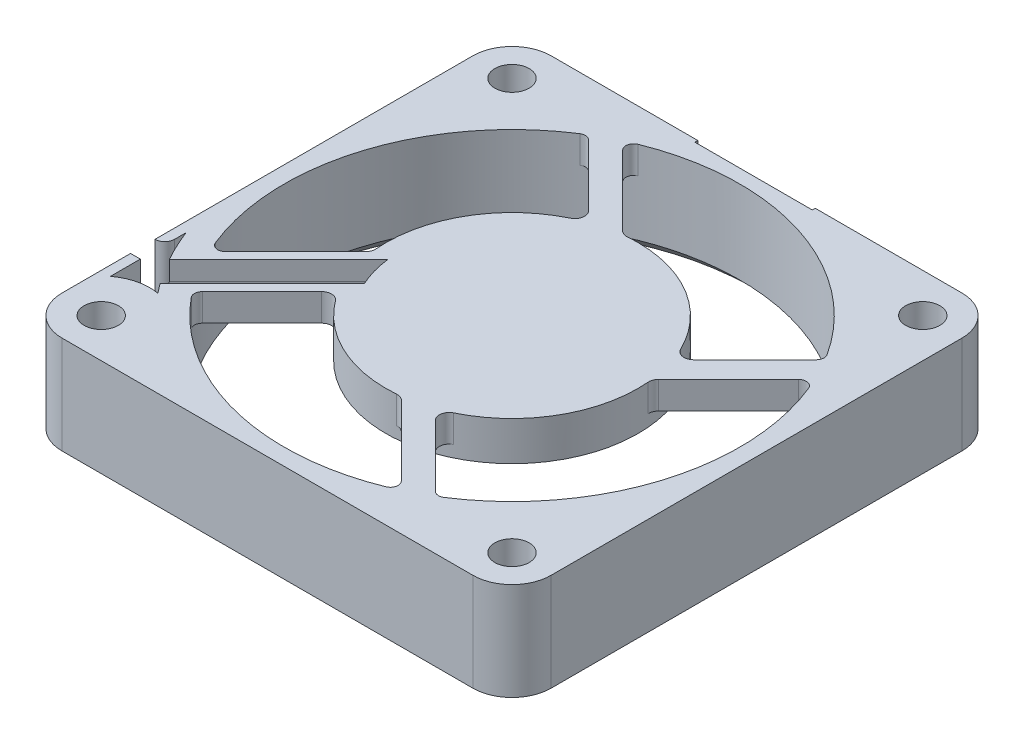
SolidWorks part; units mm, degrees
ref_plane "Спереди" through (0, 0, 0) normal (0, 0, 1) x (1, 0, 0)
ref_plane "Сверху" through (0, 0, 0) normal (0, 1, 0) x (1, 0, 0)
ref_plane "Справа" through (0, 0, 0) normal (1, 0, 0) x (0, 0, -1)
sketch "Эскиз1" plane through (0, 0, 0) normal (0, 1, 0) x (1, 0, 0)
  line L5 (371.8761, 130.3707) -> (371.8761, 129.2014)
  line L6 (370.8761, 160.7014) -> (370.8761, 128.2014)
  line L7 (389.8761, 164.7014) -> (374.8761, 164.7014)
  line L8 (389.8761, 164.7014) -> (389.8761, 164.4014)
  line L9 (401.8761, 164.4014) -> (389.8761, 164.4014)
  line L10 (401.8761, 164.4014) -> (401.8761, 164.7014)
  line L11 (416.8761, 164.7014) -> (401.8761, 164.7014)
  line L12 (420.8761, 118.7014) -> (420.8761, 160.7014)
  line L13 (374.8761, 114.7014) -> (416.8761, 114.7014)
  line L14 (370.8761, 125.7014) -> (370.8761, 118.7014)
  line L15 (370.8761, 125.7014) -> (371.8761, 125.7014)
  line L16 (371.8761, 122.6388) -> (371.8761, 125.7014)
  line L17 (384.0282, 132.0963) -> (377.9211, 125.9891)
  line L18 (415.3463, 151.3369) -> (409.0832, 145.0738)
  line L19 (375.5766, 130.7157) -> (382.7289, 137.868)
  line L20 (404.8618, 119.402) -> (397.7095, 126.5543)
  line L21 (390.5037, 152.9086) -> (384.2406, 159.1717)
  line L22 (386.8903, 160.0009) -> (394.0426, 152.8486)
  line L23 (401.2484, 126.4943) -> (407.5115, 120.2312)
  line L24 (409.0232, 141.5349) -> (416.1755, 148.6872)
  arc A0 (371.8761, 130.3707) -> (373.404, 127.1289) centre (395.8761, 139.7014) ccw
  arc A1 (370.8761, 128.2014) -> (371.8761, 129.2014) centre (370.8761, 129.2014) ccw
  arc A2 (374.8761, 164.7014) -> (370.8761, 160.7014) centre (374.8761, 160.7014) ccw
  arc A3 (420.8761, 160.7014) -> (416.8761, 164.7014) centre (416.8761, 160.7014) ccw
  arc A4 (416.8761, 114.7014) -> (420.8761, 118.7014) centre (416.8761, 118.7014) ccw
  arc A5 (370.8761, 118.7014) -> (374.8761, 114.7014) centre (374.8761, 118.7014) ccw
  arc A6 (375.8114, 123.5623) -> (371.8761, 122.6388) centre (374.8761, 118.7014) ccw
  arc A7 (375.0607, 124.5429) -> (375.8114, 123.5623) centre (395.8761, 139.7014) ccw
  circle A8 centre (416.8761, 160.7014) radius 1.75
  circle A9 centre (374.8761, 118.7014) radius 1.75
  circle A10 centre (416.8761, 118.7014) radius 1.75
  circle A11 centre (374.8761, 160.7014) radius 1.75
  arc A12 (377.8685, 124.9158) -> (404.5955, 118.0945) centre (395.8761, 139.7014) ccw
  arc A13 (377.9211, 125.9891) -> (377.8685, 124.9158) centre (378.4868, 125.4234) ccw
  arc A14 (385.5368, 131.9872) -> (396.9214, 126.8439) centre (395.8761, 139.7014) ccw
  arc A15 (385.5368, 131.9872) -> (384.0282, 132.0963) centre (384.7353, 131.3892) ccw
  arc A16 (415.3463, 151.3369) -> (415.4528, 152.3364) centre (414.7806, 151.9026) ccw
  arc A17 (382.7289, 137.868) -> (383.0185, 138.6561) centre (382.0218, 138.5751) ccw
  arc A18 (404.5955, 118.0945) -> (404.8618, 119.402) centre (404.2961, 118.8363) ccw
  arc A19 (397.7095, 126.5543) -> (396.9214, 126.8439) centre (397.0024, 125.8472) ccw
  arc A20 (390.234, 151.3022) -> (390.5037, 152.9086) centre (389.7966, 152.2014) ccw
  arc A21 (394.0426, 152.8486) -> (394.8307, 152.559) centre (394.7497, 153.5557) ccw
  arc A22 (407.5115, 120.2312) -> (408.5111, 120.1247) centre (408.0772, 120.7969) ccw
  arc A23 (383.2411, 159.2781) -> (374.2691, 130.982) centre (395.8761, 139.7014) ccw
  arc A24 (374.2691, 130.982) -> (375.5766, 130.7157) centre (375.011, 131.2814) ccw
  arc A25 (387.1567, 161.3084) -> (386.8903, 160.0009) centre (387.456, 160.5666) ccw
  arc A26 (407.4768, 145.3435) -> (409.0832, 145.0738) centre (408.3761, 145.7809) ccw
  arc A27 (417.4831, 148.4209) -> (416.1755, 148.6872) centre (416.7412, 148.1215) ccw
  arc A28 (408.5111, 120.1247) -> (417.4831, 148.4209) centre (395.8761, 139.7014) ccw
  arc A29 (409.0232, 141.5349) -> (408.7336, 140.7468) centre (409.7304, 140.8278) ccw
  arc A30 (401.5182, 128.1007) -> (401.2484, 126.4943) centre (401.9555, 127.2014) ccw
  arc A31 (415.4528, 152.3364) -> (387.1567, 161.3084) centre (395.8761, 139.7014) ccw
  arc A32 (390.234, 151.3022) -> (383.0185, 138.6561) centre (395.8761, 139.7014) ccw
  arc A33 (384.2406, 159.1717) -> (383.2411, 159.2781) centre (383.6749, 158.606) ccw
  arc A34 (401.5182, 128.1007) -> (408.7336, 140.7468) centre (395.8761, 139.7014) ccw
  arc A35 (407.4768, 145.3435) -> (394.8307, 152.559) centre (395.8761, 139.7014) ccw
  arc A36 (373.404, 127.1289) -> (375.0607, 124.5429) centre (395.8761, 139.7014) ccw
extrude "Бобышка-Вытянуть1" add sketch "Эскиз1" along normal blind 10
sketch "Эскиз3" plane through (0, 0, 0) normal (0, -1, 0) x (1, 0, 0)
  circle A0 centre (395.8761, -139.7014) radius 23.3
extrude "Вырез-Вытянуть1" cut sketch "Эскиз3" against normal blind 6
sketch "Эскиз4" plane through (0, 6, 0) normal (0, -1, 0) x (1, 0, 0)
  circle A0 centre (395.8761, -139.7014) radius 12.9
  circle A1 centre (395.8761, -139.7014) radius 23.3
extrude "Вырез-Вытянуть2" cut sketch "Эскиз4" against normal blind 1.2
sketch "Эскиз5" plane through (0, 0, 0) normal (0, -1, 0) x (1, 0, 0)
  line L0 (419.8761, -122.6388) -> (419.8761, -130.3707)
  line L1 (371.8761, -156.7641) -> (371.8761, -149.0322)
  line L2 (405.2068, -115.7014) -> (412.9387, -115.7014)
  line L3 (412.9387, -163.7014) -> (405.2068, -163.7014)
  line L4 (419.8761, -149.0322) -> (419.8761, -156.7641)
  line L5 (378.8134, -115.7014) -> (386.5453, -115.7014)
  line L6 (386.5453, -163.7014) -> (378.8134, -163.7014)
  arc A0 (415.9407, -123.5623) -> (419.8761, -122.6388) centre (416.8761, -118.7014) ccw
  arc A1 (419.8761, -130.3707) -> (415.9407, -123.5623) centre (395.8761, -139.7014) ccw
  arc A2 (375.8114, -155.8406) -> (371.8761, -156.7641) centre (374.8761, -160.7014) ccw
  arc A3 (371.8761, -149.0322) -> (375.8114, -155.8406) centre (395.8761, -139.7014) ccw
  arc A4 (412.0152, -119.6368) -> (405.2068, -115.7014) centre (395.8761, -139.7014) ccw
  arc A5 (412.9387, -115.7014) -> (412.0152, -119.6368) centre (416.8761, -118.7014) ccw
  arc A6 (412.0152, -159.7661) -> (412.9387, -163.7014) centre (416.8761, -160.7014) ccw
  arc A7 (405.2068, -163.7014) -> (412.0152, -159.7661) centre (395.8761, -139.7014) ccw
  arc A8 (415.9407, -155.8406) -> (419.8761, -149.0322) centre (395.8761, -139.7014) ccw
  arc A9 (419.8761, -156.7641) -> (415.9407, -155.8406) centre (416.8761, -160.7014) ccw
  arc A10 (379.7369, -119.6368) -> (378.8134, -115.7014) centre (374.8761, -118.7014) ccw
  arc A11 (386.5453, -115.7014) -> (379.7369, -119.6368) centre (395.8761, -139.7014) ccw
  arc A12 (379.7369, -159.7661) -> (386.5453, -163.7014) centre (395.8761, -139.7014) ccw
  arc A13 (378.8134, -163.7014) -> (379.7369, -159.7661) centre (374.8761, -160.7014) ccw
  circle A17 centre (395.8761, -139.7014) radius 12.9
  circle A18 centre (395.8761, -139.7014) radius 12.9 construction
  dimension "D1" = 0
extrude "Вырез-Вытянуть3" cut sketch "Эскиз5" against normal blind 8.45
chamfer "Фаска1" distance 1.5 angle 45 1 edges at (395.8761, 0, -116.4014)
sketch "Эскиз6" plane through (0, 0, 0) normal (0, -1, 0) x (1, 0, 0)
  circle A0 centre (374.8761, -118.7014) radius 3.2
  circle A1 centre (416.8761, -118.7014) radius 3.2
  circle A2 centre (416.8761, -160.7014) radius 3.2
  circle A3 centre (374.8761, -160.7014) radius 3.2
  dimension "D1" = 6.4
extrude "Вырез-Вытянуть4" cut sketch "Эскиз6" against normal blind 3
sketch "Эскиз7" plane through (0, 10, 0) normal (0, 1, 0) x (1, 0, 0)
  line L0 (385.4991, 134.9814) -> (375.0607, 124.5429)
  line L1 (373.404, 127.1289) -> (384.5639, 138.2888)
  arc A0 (384.5639, 138.2888) -> (385.4991, 134.9814) centre (395.8761, 139.7014) ccw
  arc A3 (371.8761, 130.3707) -> (375.8114, 123.5623) centre (395.8761, 139.7014) ccw
  circle A4 centre (395.8761, 139.7014) radius 12.9
  circle A5 centre (395.8761, 139.7014) radius 12.9 construction
  arc A6 (373.404, 127.1289) -> (375.0607, 124.5429) centre (395.8761, 139.7014) ccw
  dimension "D1" = 0
  dimension "D2" = 0
extrude "Вырез-Вытянуть5" cut sketch "Эскиз7" against normal blind 2
sketch "Эскиз8" plane through (0, 0, -164.7014) normal (0, 0, -1) x (-1, 0, 0)
  line L0 (-399.5761, 5) -> (-399.8761, 5)
  line L1 (-399.0761, 6.4) -> (-398.2761, 5)
  line L2 (-398.5761, 5) -> (-398.2761, 5)
  line L3 (-398.5761, 3.7) -> (-399.5761, 3.7)
  line L4 (-399.8761, 5) -> (-399.0761, 6.4)
  line L5 (-399.5761, 3.7) -> (-399.5761, 5)
  line L6 (-398.5761, 5) -> (-398.5761, 3.7)
  line L7 (-393.8761, 5.5) -> (-392.5761, 5.5)
  line L8 (-392.5761, 4.2) -> (-392.5761, 4.5)
  line L9 (-392.5761, 4.5) -> (-393.8761, 4.5)
  line L10 (-392.5761, 5.5) -> (-392.5761, 5.8)
  line L11 (-393.8761, 4.5) -> (-393.8761, 5.5)
  line L12 (-392.5761, 5.8) -> (-391.1761, 5)
  line L13 (-391.1761, 5) -> (-392.5761, 4.2)
  line L17 (-401.8761, 10) -> (-389.8761, 10)
  line L18 (-401.8761, 10) -> (-389.8761, 10) construction
  dimension "D1" = 0
extrude "Бобышка-Вытянуть2" add sketch "Эскиз8" against normal up to surface (0.3 mm away)
